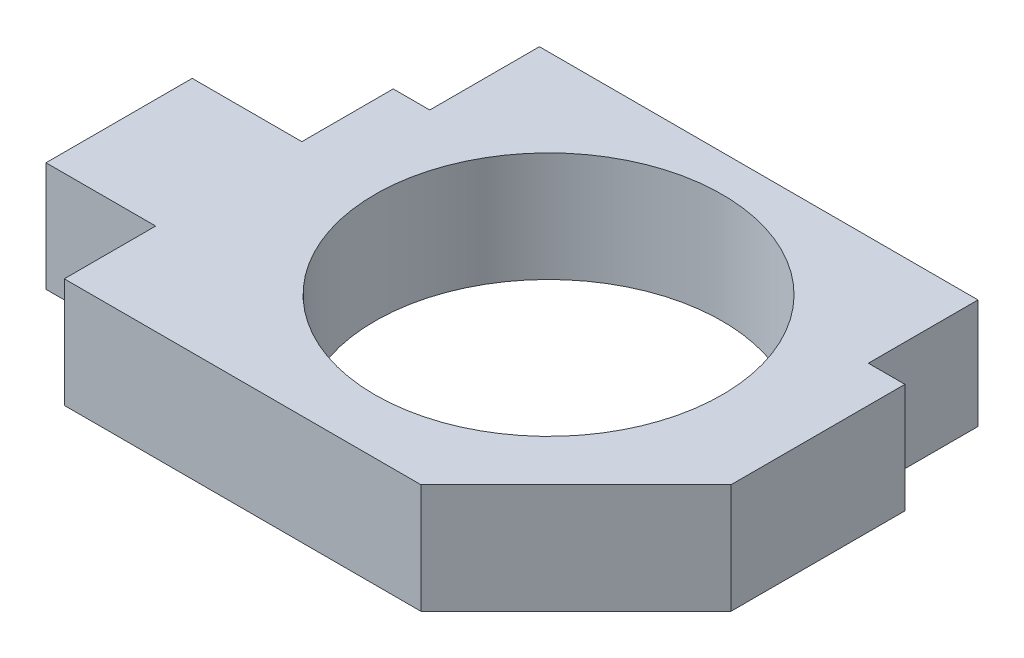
SolidWorks part; units mm, degrees
ref_plane "Front Plane" through (0, 0, 0) normal (0, 0, 1) x (1, 0, 0)
ref_plane "Top Plane" through (0, 0, 0) normal (0, 1, 0) x (1, 0, 0)
ref_plane "Right Plane" through (0, 0, 0) normal (1, 0, 0) x (0, 0, -1)
sketch "Sketch1" plane through (0, 0, 0) normal (0, 1, 0) x (1, 0, 0)
  line L0 (7, -0.2574) -> (2.7574, -4.5)
  line L1 (-7, 4.5) -> (7, 4.5)
  line L2 (-7, 4.5) -> (-7, -4.5)
  line L3 (-7, -4.5) -> (2.7574, -4.5)
  line L4 (7, 4.5) -> (7, -0.2574)
  line L5 (-7, 4.5) -> (7, -4.5) construction
  line L6 (-7, -4.5) -> (7, 4.5) construction
  line L7 (2.7574, -4.5) -> (7, -4.5) construction
  line L8 (7, -4.5) -> (7, -0.2574) construction
  point P0 (0, 0)
  dimension "D1" = 14
  dimension "D2" = 9
  dimension "D4" = 45
  dimension "D5" = 3
extrude "Boss-Extrude1" add sketch "Sketch1" along normal blind 3
sketch "Sketch2" plane through (0, 0, 0) normal (0, 1, 0) x (1, 0, 0)
  line L0 (0, 4.5) -> (0, 6) construction
  line L1 (7, 4.5) -> (-7, 4.5) construction
  line L2 (-7, 0) -> (-8.5, 0) construction
  line L3 (-7, 4.5) -> (-7, -4.5) construction
  line L5 (-10, 2) -> (-7, 2)
  line L6 (-10, 2) -> (-10, -2)
  line L7 (-10, -2) -> (-7, -2)
  line L8 (-7, 2) -> (-7, -2)
  line L9 (-10, 2) -> (-7, -2) construction
  line L10 (-10, -2) -> (-7, 2) construction
  line L11 (-6, 7.5) -> (6, 7.5)
  line L12 (-6, 7.5) -> (-6, 4.5)
  line L13 (-6, 4.5) -> (6, 4.5)
  line L14 (6, 7.5) -> (6, 4.5)
  line L15 (-6, 7.5) -> (6, 4.5) construction
  line L16 (-6, 4.5) -> (6, 7.5) construction
  dimension "D1" = 3
  dimension "D2" = 4
  dimension "D3" = 12
extrude "Boss-Extrude2" add sketch "Sketch2" along normal blind 3
sketch "Sketch4" plane through (0, 0, 0) normal (0, 1, 0) x (1, 0, 0)
  line L0 (0, 0) -> (0, 1.75) construction
  line L3 (6, 7.5) -> (-6, 7.5) construction
  circle A0 centre (0, 1.75) radius 4.75
  point P4 (0, 7.5)
  dimension "D1" = 9.5
  dimension "D2" = 5.75
extrude "Cut-Extrude3" cut sketch "Sketch4" along normal blind 3
